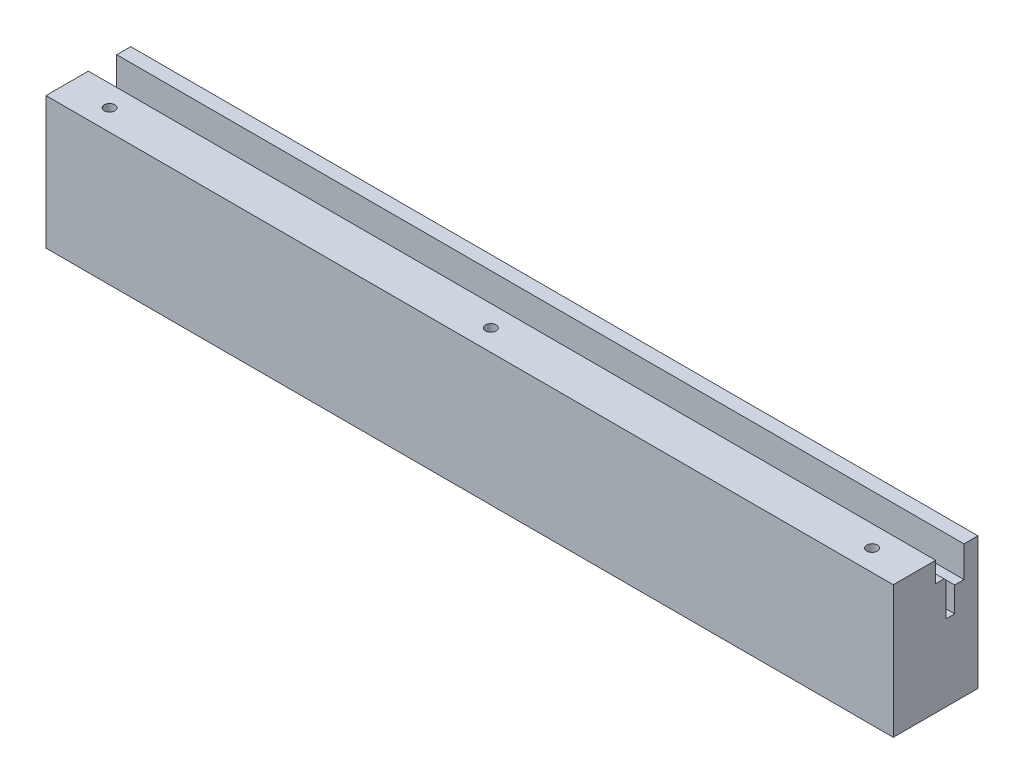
SolidWorks part; units mm, degrees
ref_plane "前视基准面" through (0, 0, 0) normal (0, 0, 1) x (1, 0, 0)
ref_plane "上视基准面" through (0, 0, 0) normal (0, 1, 0) x (1, 0, 0)
ref_plane "右视基准面" through (0, 0, 0) normal (1, 0, 0) x (0, 0, -1)
sketch "草图1" plane through (0, 0, 0) normal (0, 0, 1) x (1, 0, 0)
  line L0 (0, 0) -> (200, 0)
  line L1 (0, 31.2) -> (200, 31.2)
  line L2 (200, 0) -> (200, 31.2)
  line L3 (0, 0) -> (0, 31.2)
extrude "凸台-拉伸1" add sketch "草图1" along normal blind 20
sketch "草图2" plane through (200, 0, 0) normal (1, 0, 0) x (0, 0, -1)
  line L0 (-5.5, 18) -> (-5.5, 23.9)
  line L1 (-7.5, 18) -> (-7.5, 25.9)
  line L2 (-7.5, 18) -> (-5.5, 18)
  line L3 (-20, 31.2) -> (-10, 31.2)
  line L4 (-3.3, 23.9) -> (-3.3, 31.2)
  line L5 (-10, 26.4) -> (-10, 31.2)
  line L6 (-20, 0) -> (0, 0)
  line L7 (0, 0) -> (0, 31.2)
  line L8 (-20, 0) -> (-20, 31.2)
  line L9 (-10, 26.4) -> (-8, 26.4)
  line L10 (-3.3, 31.2) -> (0, 31.2)
  line L11 (-5.5, 23.9) -> (-3.3, 23.9)
  line L12 (-8, 26.4) -> (-7.5, 25.9)
extrude "切除-拉伸1" cut sketch "草图2" against normal through all flip side to cut
sketch "草图3" plane through (0, 31.2, 0) normal (0, 1, 0) x (1, 0, 0)
  circle A0 centre (10, -15) radius 1.25
  circle A1 centre (100, -15) radius 1.25
  circle A2 centre (190, -15) radius 1.25
extrude "切除-拉伸2" cut sketch "草图3" against normal blind 20
sketch "草图4" plane through (0, 31.2, 0) normal (0, 1, 0) x (1, 0, 0)
  circle A0 centre (132.4, -15) radius 2.1 construction
  circle A1 centre (180, -15) radius 2.1 construction
sketch "草图5" plane through (0, 0, 0) normal (0, -1, 0) x (1, 0, 0)
  circle A0 centre (132.4, 15) radius 2.1
  circle A1 centre (180, 15) radius 2.1
extrude "切除-拉伸3" cut sketch "草图5" against normal blind 20
